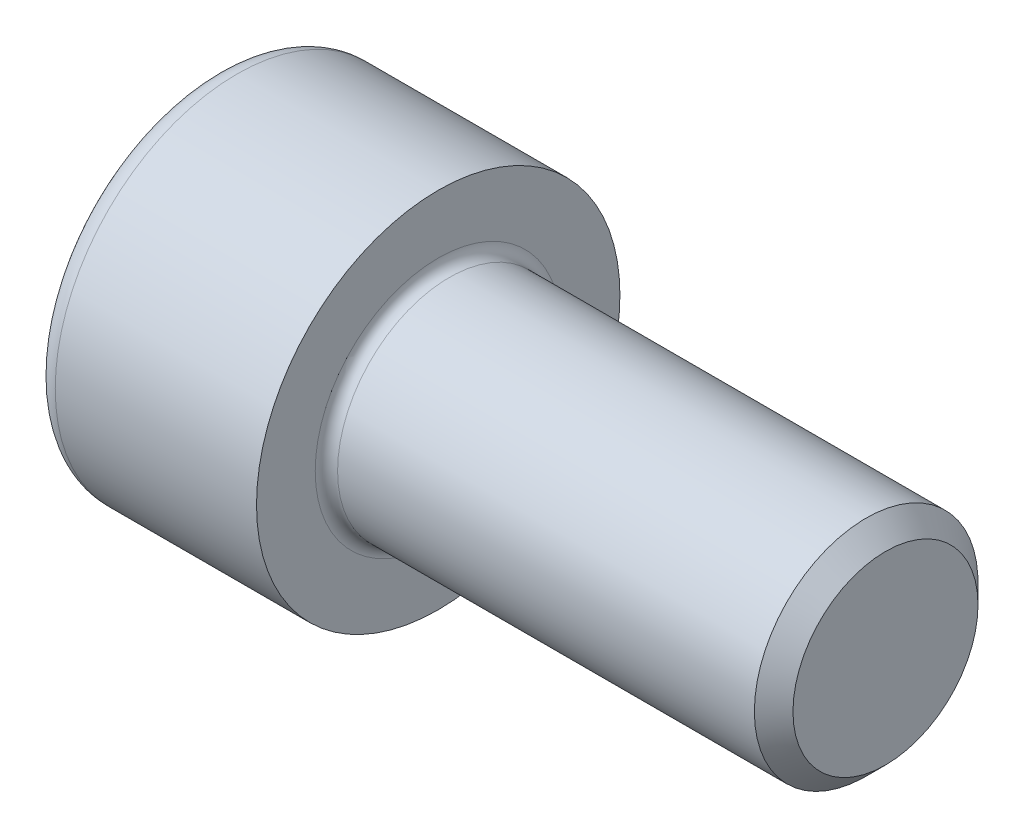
SolidWorks part; units mm, degrees
revolve "Base-Revolve" add sketch "BodySke" angle 360 about L6
sketch "BodySke" plane through (0, 0, 0) normal (0, 0, 1) x (1, 0, 0)
  line L0 (0, 0) -> (0, 6.5)
  line L1 (0, 6.5) -> (8, 6.5)
  line L2 (8, 6.5) -> (8, 4)
  line L3 (8, 4) -> (23.3095, 4)
  line L4 (24, 3.3095) -> (24, 0)
  line L5 (24, 0) -> (0, 0)
  line L6 (-31.75, 0) -> (127, 0) construction
  line L8 (24, 3.3095) -> (23.3095, 4)
  line L10 (24, -3.3095) -> (23.3095, -4) construction
  line L11 (9.25, 9.525) -> (9.25, 3.175) construction
  line L12 (8, 9.525) -> (8, 3.175) construction
  line L13 (-36, 9.525) -> (-36, 3.175) construction
  dimension "Diameter" = 8
  dimension "Head_ht" = 8
  dimension "Length" = 16
  dimension "Body_ch_ang" = 45
  dimension "Head_dia" = 13
  dimension "Minor_dia" = 6.619
  dimension "Advance" = 1.25
  dimension "Thread_nom" = 16
  dimension "Thread_length" = 60
fillet "Fillet2" radius 0.8 1 edges at (0, 0, 6.5)
ref_plane "Plane1" through (0, 0, 0) normal (0, 0, 1) x (1, 0, 0)
ref_plane "Plane2" through (0, 0, 0) normal (0, 1, 0) x (1, 0, 0)
ref_plane "Plane3" through (0, 0, 0) normal (1, 0, 0) x (0, 0, -1)
fillet "Fillet1" radius 0.4 1 edges at (8, 0, 4)
sketch "Sketch2" plane through (0, 0, 0) normal (0, 0, 1) x (1, 0, 0)
  line L0 (0, 3.01) -> (4, 3.01)
  line L1 (4, 3.01) -> (5.7378, 0)
  line L2 (-31.75, 0) -> (127, 0) construction
  line L3 (5.7378, 0) -> (0, 0)
  line L4 (0, 0) -> (0, 3.01)
  line L6 (0, 0) -> (47.625, 0) construction
revolve "Hex-PreBroach" cut sketch "Sketch2" angle 360 about L6
sketch "Sketch3" plane through (0, 0, 0) normal (-1, 0, 0) x (0, 0.5, 0.866)
  line L0 (1.7378, 3.01) -> (-1.7378, 3.01)
  line L1 (-1.7378, 3.01) -> (-3.4756, 0)
  line L2 (1.7378, 3.01) -> (3.4756, 0)
  line L3 (1.7378, -3.01) -> (3.4756, 0)
  line L4 (1.7378, -3.01) -> (-1.7378, -3.01)
  line L5 (-1.7378, -3.01) -> (-3.4756, 0)
extrude "Hex" cut sketch "Sketch3" against normal blind 4
sketch "ThdSchSke" plane through (0, 0, 0) normal (0, 0, 1) x (1, 0, 0)
  line L0 (11.75, -3.3095) -> (11.2665, -4)
  line L1 (11.75, -3.3095) -> (12.2335, -4)
  line L2 (12.2335, -4) -> (12.2335, -5)
  line L3 (-3.175, 0) -> (5.1513, 0) construction
  line L4 (0, 5.7) -> (0, -5.7) construction
  line L5 (12.2335, -5) -> (11.2665, -5)
  line L6 (11.2665, -5) -> (11.2665, -4)
revolve "ThreadSchematic" [suppressed] cut sketch "ThdSchSke" angle 360 about L3
pattern_linear "ThdSchPat" [suppressed]
thread "Filetage1" pitch 1.25 start angle 0, offset 5, length 17, pitch 1.25, diameter 8
ref_plane "Plan1" through (28.3095, 0, 4) normal (0, -1, 0) x (0, 0, 1)
sketch "Profil de filetage1" plane through (28.3095, 0, 4) normal (0, -1, 0) x (0, 0, 1)
  line L0 (0, 0) -> (0, 1.25) construction
  line L11 (0, 0) -> (0, 1.0937)
  line L12 (0, 1.0937) -> (-0.6766, 0.7031)
  line L13 (-0.6766, 0.7031) -> (-0.6766, 0.3906)
  line L15 (-0.6766, 0.3906) -> (0, 0)
  line L17 (-0.6766, 0.5469) -> (0, 0.5469) construction
  point P2 (0, 0)
  dimension "Pitch" = 1.25
  dimension "Profile_Angle" = 60
  dimension "Profile_Land" = 0.3125
  dimension "Profile_Height" = 0.6766
equation "\"D2@Sketch3\" = \"Hex_size@Sketch3\" / 2"
equation "\"D1@Sketch3\" = \"Hex_size@Sketch3\" / 2"
equation "\"D1@Sketch2\" = \"Hex_size@Sketch3\" / 2"
equation "\"Depth@Sketch2\" =  \"Key_eng@Hex\""
equation "\"Thread_minor@ThdSchSke\" = \"Minor_dia@BodySke\""
equation "\"Diameter@ThdSchSke\" = \"Diameter@BodySke\""
equation "\"Overcut@ThdSchSke\" = \"Diameter@BodySke\" * 1.25"
